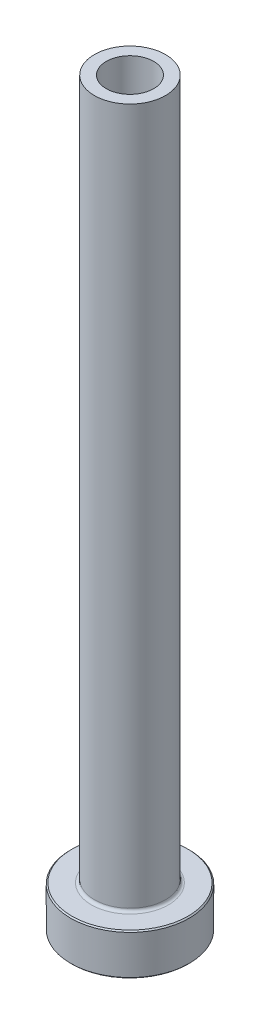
SolidWorks part; units mm, degrees
ref_plane "Front Plane" through (0, 0, 0) normal (0, 0, 1) x (1, 0, 0)
ref_plane "Top Plane" through (0, 0, 0) normal (0, 1, 0) x (1, 0, 0)
ref_plane "Right Plane" through (0, 0, 0) normal (1, 0, 0) x (0, 0, -1)
sketch "Sketch1" plane through (0, 0, 0) normal (0, 0, 1) x (1, 0, 0)
  line L0 (-4, 125) -> (-6, 125)
  line L1 (-6, 125) -> (-6, 7)
  line L2 (-6, 7) -> (-10, 7)
  line L3 (-10, 7) -> (-10, 0)
  line L4 (11, 0) -> (-11, 0) construction
  line L5 (-10, 0) -> (-4.25, 0)
  line L6 (-4, 80) -> (-4, 125)
  line L7 (0, 92.1877) -> (0, -15.5353) construction
  line L8 (0, -11) -> (0, 11) construction
  line L9 (-4, 80) -> (-4.25, 68)
  line L10 (-4.25, 68) -> (-4.25, 0)
  dimension "D1" = 0.25
  dimension "ID" = 8
  dimension "OD" = 12
  dimension "L" = 125
  dimension "H" = 20
  dimension "T" = 7
  dimension "N" = 45
  dimension "D2" = 12
revolve "Revolve1" add sketch "Sketch1" angle 360 about L7
fillet "Fillet1" radius 0.5 1 edges at (0, 7, 6)
chamfer "Chamfer1" distance 0.2 angle 45 2 edges at (0, 7, 10) (0, 0, 10)
chamfer "Chamfer3" distance 0.5 angle 45 1 edges at (0, 0, 4.25)
